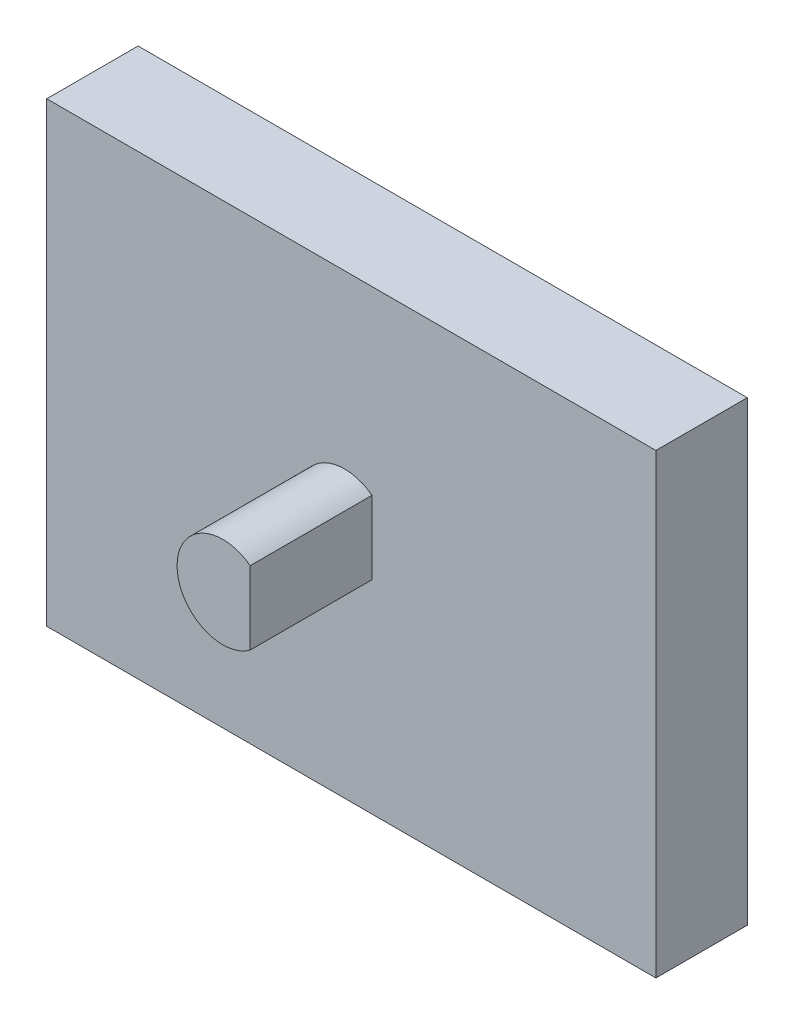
SolidWorks part; units mm, degrees
ref_plane "Front" through (0, 0, 0) normal (0, 0, 1) x (1, 0, 0)
ref_plane "Top" through (0, 0, 0) normal (0, 1, 0) x (1, 0, 0)
ref_plane "Right" through (0, 0, 0) normal (1, 0, 0) x (0, 0, -1)
sketch "Sketch1" plane through (0, 0, 0) normal (0, 0, 1) x (1, 0, 0)
  line L1 (0, 0) -> (100, 0)
  line L2 (0, 0) -> (0, 75)
  line L3 (0, 75) -> (100, 75)
  line L4 (100, 0) -> (100, 75)
  dimension "D1" = 75
  dimension "D2" = 100
extrude "Extrude1" add sketch "Sketch1" along normal blind 15
sketch "Sketch2" plane through (0, 0, 15) normal (0, 0, 1) x (1, 0, 0)
  circle A0 centre (48.8964, 39.3206) radius 7.5
  dimension "D1" = 15
extrude "Extrude2" add sketch "Sketch2" along normal blind 20
sketch "Sketch3" plane through (0, 0, 35) normal (0, 0, 1) x (1, 0, 0)
  line L0 (53.3964, 45.3206) -> (53.3964, 33.3206)
  circle A0 centre (48.8964, 39.3206) radius 7.5 construction
  arc A1 (53.3964, 33.3206) -> (53.3964, 45.3206) centre (48.8964, 39.3206) ccw
  dimension "D1" = 12
extrude "Cut-Extrude1" cut sketch "Sketch3" against normal blind 20
